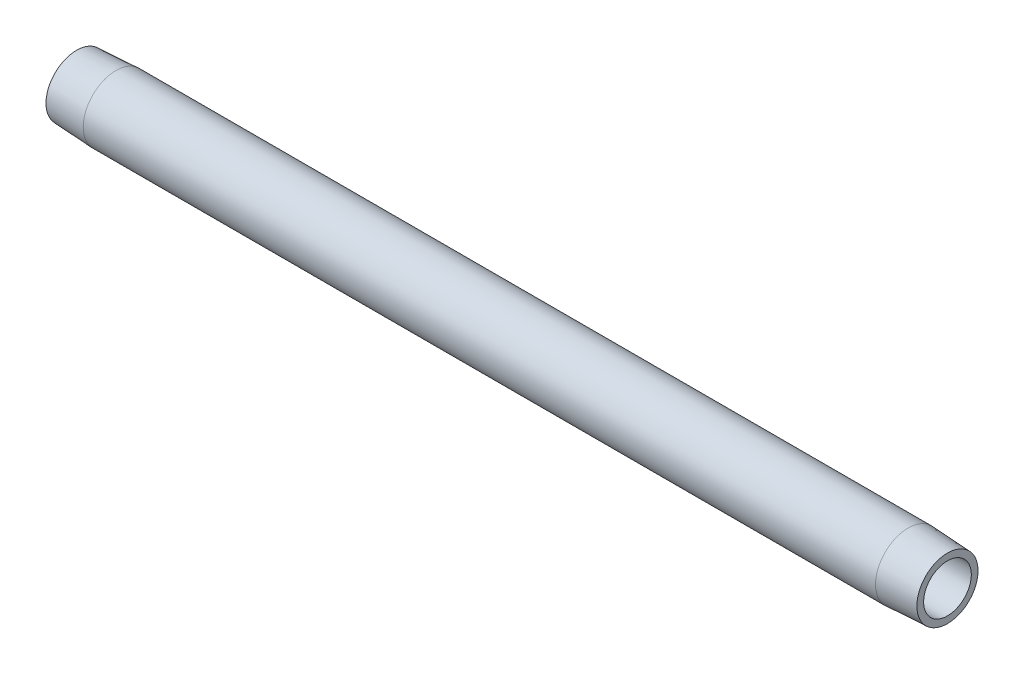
SolidWorks part; units mm, degrees
ref_plane "Front Plane" through (0, 0, 0) normal (0, 0, 1) x (1, 0, 0)
ref_plane "Top Plane" through (0, 0, 0) normal (0, 1, 0) x (1, 0, 0)
ref_plane "Right Plane" through (0, 0, 0) normal (1, 0, 0) x (0, 0, -1)
sketch "Sketch1" plane through (0, 0, 0) normal (0, 0, 1) x (1, 0, 0)
  line L5 (228.6, 6.2611) -> (0, 6.2611)
  line L6 (218.2876, 8.5725) -> (10.3124, 8.5725)
  line L7 (10.3124, 8.5725) -> (0, 8.0321)
  line L8 (228.6, 8.0321) -> (218.2876, 8.5725)
  line L9 (228.6, 6.2611) -> (228.6, 8.0321)
  line L10 (0, 6.2611) -> (0, 8.0321)
  line L11 (0, 0) -> (50000, 0) construction
  line L12 (0, -55) -> (0, 55) construction
  dimension "D1" = 12.5222
  dimension "D2" = 17.145
  dimension "D3" = 3
  dimension "D4" = 3
  dimension "D5" = 228.6
  dimension "D6" = 10.3124
  dimension "D7" = 10.3124
revolve "Revolve1" add sketch "Sketch1" angle 360 about L11
